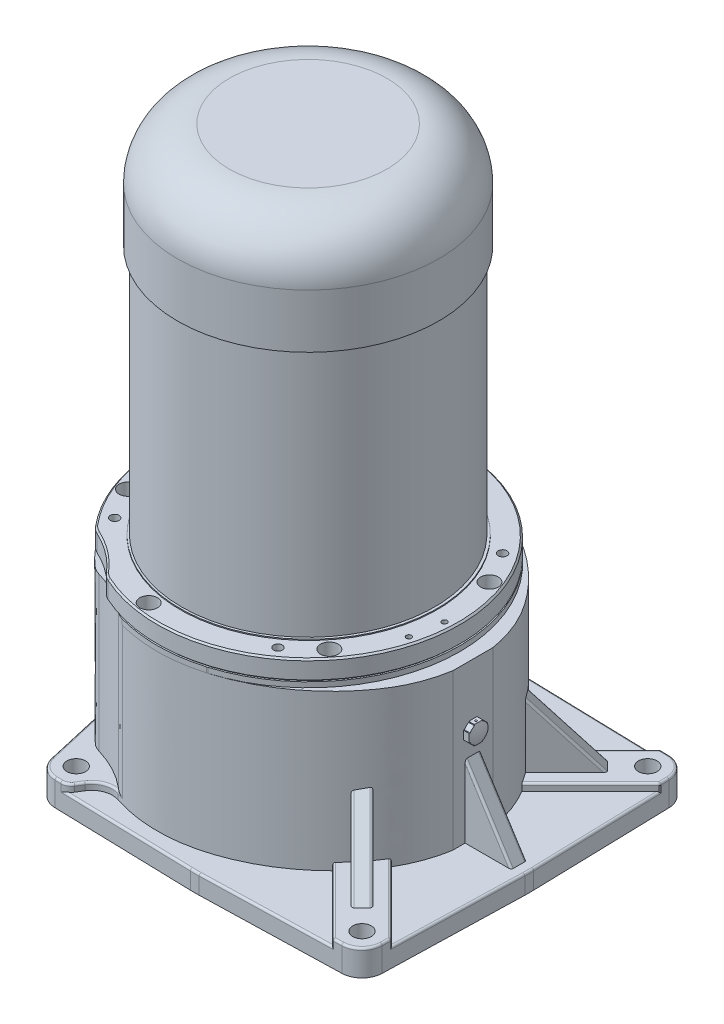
SolidWorks part; units mm, degrees
ref_plane "前视基准面" through (0, 0, 0) normal (0, 0, 1) x (1, 0, 0)
ref_plane "上视基准面" through (0, 0, 0) normal (0, 1, 0) x (1, 0, 0)
ref_plane "右视基准面" through (0, 0, 0) normal (1, 0, 0) x (0, 0, -1)
imported_body "50箱盖-1-surface1"
imported_body "复件 5034.2200.106-00-1-surface1"
imported_body "复件 5034.2200.106-00-1-surface2"
imported_body "复件 5034.2200.106-00-1-surface3"
imported_body "复件 5034.2200.106-00-1-surface4"
imported_body "复件 5034.2200.106-00-1-surface5"
imported_body "复件 5034.2200.106-00-1-surface6"
imported_body "复件 5034.2200.106-00-1-surface7"
imported_body "复件 5034.2200.106-00-1-surface8"
imported_body "复件 5034.2200.106-00-1-surface9"
imported_body "复件 5034.2200.106-00-1-surface10"
imported_body "复件 5034.2200.106-00-1-surface11"
imported_body "复件 5034.2200.106-00-1-surface13"
imported_body "复件 5034.2200.106-00-1-surface14"
imported_body "复件 5034.2200.106-00-1-surface15"
imported_body "复件 5034.2200.106-00-1-surface16"
imported_body "复件 5034.2200.106-00-1-surface17"
imported_body "复件 5034.2200.106-00-1-surface18"
imported_body "复件 5034.2200.106-00-1-surface19"
imported_body "复件 5034.2200.106-00-1-surface20"
imported_body "复件 5034.2200.106-00-1-surface21"
imported_body "复件 5034.2200.106-00-1-surface22"
imported_body "复件 5034.2200.106-00-1-surface23"
imported_body "复件 5034.2200.106-00-1-surface24"
imported_body "复件 5034.2200.106-00-1-surface25"
imported_body "复件 5034.2200.106-00-1-surface26"
imported_body "复件 5034.2200.106-00-1-surface27"
imported_body "复件 5034.2200.106-00-1-surface28"
imported_body "复件 5034.2200.106-00-1-surface29"
imported_body "复件 5034.2200.106-00-1-surface30"
imported_body "复件 5034.2200.106-00-1-surface31"
imported_body "复件 5034.2200.106-00-1-surface32"
imported_body "复件 5034.2200.106-00-1-surface33"
imported_body "复件 5034.2200.106-00-1-surface34"
imported_body "复件 5034.2200.106-00-1-surface35"
imported_body "复件 5034.2200.106-00-1-surface36"
imported_body "复件 5034.2200.106-00-1-surface37"
imported_body "复件 5034.2200.106-00-1-surface38"
imported_body "复件 5034.2200.106-00-1-surface39"
imported_body "复件 5034.2200.106-00-1-surface40"
imported_body "复件 5034.2200.106-00-1-surface41"
imported_body "复件 5034.2200.106-00-1-surface42"
imported_body "复件 5034.2200.106-00-1-surface43"
imported_body "复件 5034.2200.106-00-1-surface44"
imported_body "复件 5034.2200.106-00-1-surface45"
imported_body "复件 5034.2200.106-00-1-surface46"
imported_body "复件 5034.2200.106-00-1-surface47"
imported_body "复件 5034.2200.106-00-1-surface48"
imported_body "复件 5034.2200.106-00-1-surface49"
imported_body "复件 5034.2200.106-00-1-surface50"
imported_body "复件 5034.2200.106-00-1-surface51"
imported_body "复件 5034.2200.106-00-1-surface52"
imported_body "复件 5034.2200.106-00-1-surface53"
imported_body "复件 5034.2200.106-00-1-surface54"
imported_body "复件 5034.2200.106-00-1-surface55"
imported_body "复件 5034.2200.106-00-1-surface56"
imported_body "复件 5034.2200.106-00-1-surface57"
imported_body "复件 5034.2200.106-00-1-surface58"
imported_body "立式箱体-2-surface1"
imported_body "立式箱体-2-surface2"
imported_body "立式箱体-2-surface3"
imported_body "透气塞-1-surface1"
sketch "草图3" plane through (0, -196.7551, 0) normal (0, 1, 0) x (1, 0, 0)
  circle A0 centre (15.5509, 127.454) radius 122
  circle A1 centre (67.5509, 127.454) radius 52 construction
extrude "凸台-拉伸1" add sketch "草图3" along normal blind 242
sketch "草图4" plane through (0, 45.2449, 0) normal (0, 1, 0) x (1, 0, 0)
  circle A0 centre (15.5509, 127.454) radius 126
extrude "凸台-拉伸2" add sketch "草图4" along normal blind 102
fillet "圆角1" radius 50 1 edges at (15.5509, 147.2449, -1.454)
